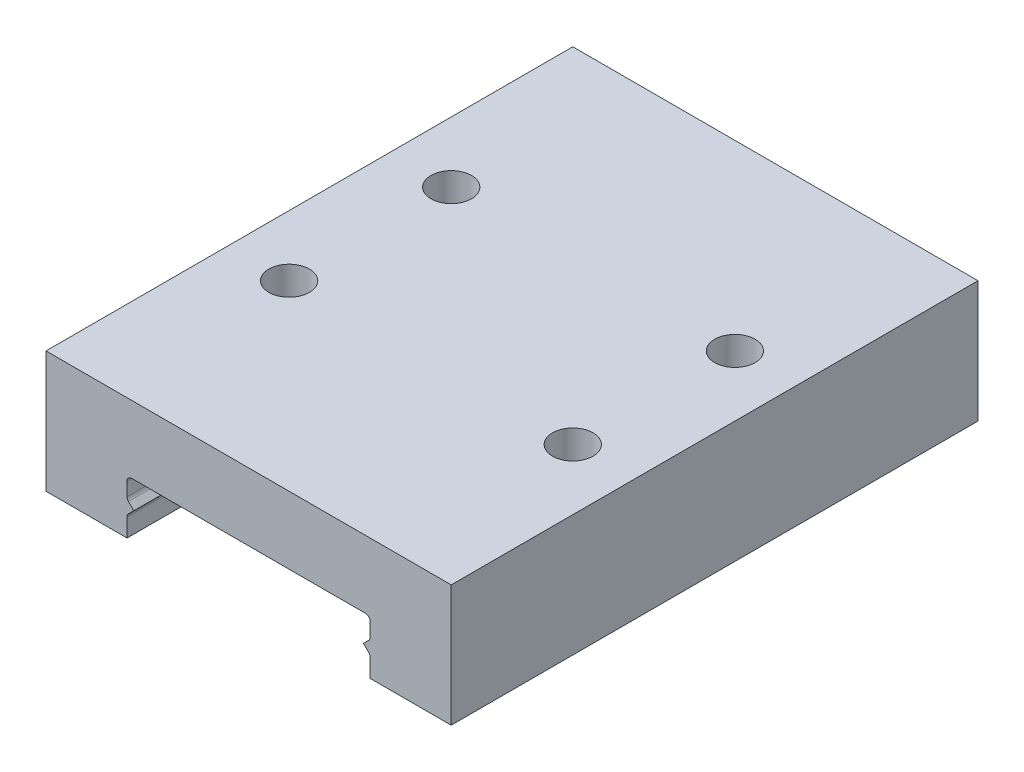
SolidWorks part; units mm, degrees
ref_plane "Front" through (0, 0, 0) normal (0, 0, 1) x (1, 0, 0)
ref_plane "Top" through (0, 0, 0) normal (0, 1, 0) x (1, 0, 0)
ref_plane "Right" through (0, 0, 0) normal (1, 0, 0) x (0, 0, -1)
sketch "Sketch1" plane through (0, 0, 0) normal (0, 0, 1) x (1, 0, 0)
  line L1 (-15, 12) -> (15, 12)
  line L2 (-15, 12) -> (-15, 3)
  line L3 (-15, 3) -> (15, 3)
  line L4 (15, 12) -> (15, 3)
  point P4 (0, 3)
  dimension "D1" = 30
  dimension "D2" = 9
  dimension "D3" = 12
extrude "Extrude1" add sketch "Sketch1" along normal blind 39
sketch "Sketch2" plane through (0, 0, 0) normal (0, 0, -1) x (-1, 0, 0)
  line L0 (8.5, 5) -> (9, 4.5)
  line L1 (0, 7) -> (9, 7)
  line L2 (0, 7) -> (0, 0.8302)
  line L3 (0, 0.8302) -> (9, 0.8302)
  line L4 (9, 0.8302) -> (9, 4.5)
  line L5 (9, 7) -> (9, 5.5)
  line L6 (9, 5.5) -> (8.5, 5)
  dimension "D1" = 7
  dimension "D2" = 9
  dimension "D3" = 1
  dimension "D4" = 1.5
extrude "Cut-Extrude1" cut sketch "Sketch2" against normal through all
fillet "Fillet1" radius 0.35 3 edges at (-9, 5.5, 19.5) (-9, 7, 19.5) (-9, 4.5, 19.5)
mirror "Mirror1" about plane through (0, 0, 0) normal (1, 0, 0) of "Cut-Extrude1", "Fillet1"
hole_wizard "M3x0.5 Tapped Hole1" positions "Sketch4" profile "Sketch3" tap size "M3x0.5" standard "Ansi Metric"
sketch "Sketch4" plane through (0, 12, 0) normal (0, 1, 0) x (-1, 0, 0)
  line L0 (-15, 0) -> (15, 0) construction
  line L1 (15, 39) -> (15, 0) construction
  point P0 (10.5, 13.5)
  dimension "D1" = 13.5
  dimension "D2" = 4.5
sketch "Sketch3" plane through (-10.5, 12, 13.5) normal (1, 0, 0) x (0, 0, 1)
  line L0 (0, 0) -> (0, 5.2511)
  line L1 (0, 5.2511) -> (1.25, 4.5)
  line L2 (1.25, 4.5) -> (1.25, 3)
  line L3 (1.25, 3) -> (1.5, 3)
  line L4 (1.5, 3) -> (1.5, 0)
  line L5 (1.5, 0) -> (0, 0)
  line L10 (0, 5.2511) -> (-1.25, 4.5) construction
  line L11 (0, -6.35) -> (0, 107.95) construction
  dimension "Tap Drill Dia." = 2.5
  dimension "Tap Drill Depth" = 4.5
  dimension "Thread Major Dia." = 3
  dimension "Thread Depth" = 3
  dimension "Drill Angle" = 118
pattern_linear "LPattern2" count 2 spacing 12 along (0, 0, 1) count 2 spacing 21 along (1, 0, 0) of "M3x0.5 Tapped Hole1"
